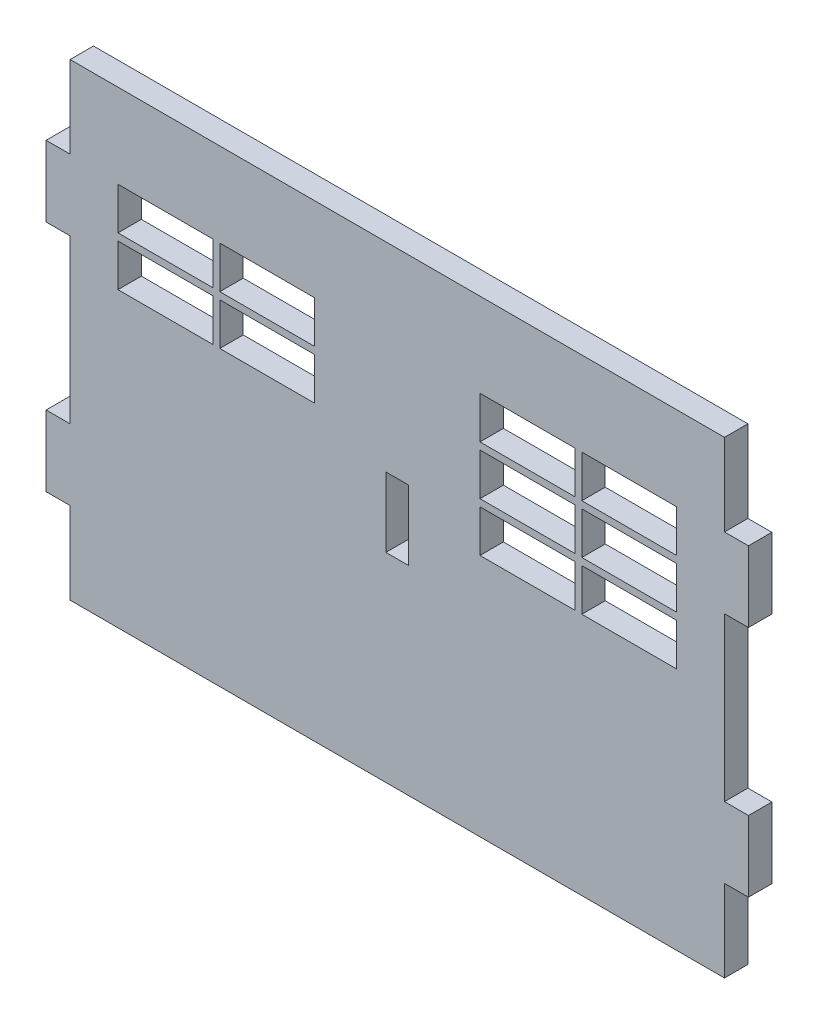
SolidWorks part; units mm, degrees
ref_plane "Front Plane" through (0, 0, 0) normal (0, 0, 1) x (1, 0, 0)
ref_plane "Top Plane" through (0, 0, 0) normal (0, 1, 0) x (1, 0, 0)
ref_plane "Right Plane" through (0, 0, 0) normal (1, 0, 0) x (0, 0, -1)
sketch "Laterale1" plane through (0, 0, 0) normal (0, 0, 1) x (1, 0, 0)
  line L0 (63.0435, 69.8758) -> (63.0435, -130.1242) construction
  line L1 (-76.7165, 69.8758) -> (202.8035, 69.8758)
  line L2 (-76.7165, 69.8758) -> (-76.7165, 34.8758)
  line L3 (-76.7165, -130.1242) -> (202.8035, -130.1242)
  line L4 (202.8035, 69.8758) -> (202.8035, 34.8758)
  line L5 (-14.2757, 33.9625) -> (-14.2757, -26.0375) construction
  line L6 (-56.2757, 33.9625) -> (-15.7757, 33.9625)
  line L7 (-56.2757, 33.9625) -> (-56.2757, 15.9625)
  line L8 (-56.2757, -26.0375) -> (-15.7757, -26.0375) construction
  line L9 (27.7243, 33.9625) -> (27.7243, 15.9625)
  line L10 (-15.7757, 33.9625) -> (-15.7757, 15.9625)
  line L11 (-56.2757, 15.9625) -> (-15.7757, 15.9625)
  line L12 (-56.2757, 12.9625) -> (-15.7757, 12.9625)
  line L13 (-56.2757, -5.0375) -> (-15.7757, -5.0375)
  line L14 (-56.2757, -8.0375) -> (-15.7757, -8.0375) construction
  line L15 (-56.2757, 12.9625) -> (-56.2757, -5.0375)
  line L16 (-56.2757, -8.0375) -> (-56.2757, -26.0375) construction
  line L17 (-15.7757, -8.0375) -> (-15.7757, -26.0375) construction
  line L18 (-15.7757, 12.9625) -> (-15.7757, -5.0375)
  line L19 (-12.7757, 33.9625) -> (27.7243, 33.9625)
  line L20 (-12.7757, -26.0375) -> (27.7243, -26.0375) construction
  line L21 (-12.7757, -8.0375) -> (-12.7757, -26.0375) construction
  line L22 (-12.7757, 12.9625) -> (-12.7757, -5.0375)
  line L23 (-12.7757, 33.9625) -> (-12.7757, 15.9625)
  line L24 (27.7243, -8.0375) -> (-12.7757, -8.0375) construction
  line L25 (27.7243, -5.0375) -> (-12.7757, -5.0375)
  line L26 (27.7243, 12.9625) -> (-12.7757, 12.9625)
  line L27 (27.7243, 15.9625) -> (-12.7757, 15.9625)
  line L28 (27.7243, -8.0375) -> (27.7243, -26.0375) construction
  line L29 (27.7243, 12.9625) -> (27.7243, -5.0375)
  line L30 (140.3626, 33.9625) -> (140.3626, -26.0375) construction
  line L31 (98.3626, 12.9625) -> (98.3626, -5.0375)
  line L32 (98.3626, -8.0375) -> (98.3626, -26.0375)
  line L33 (98.3626, 15.9625) -> (138.8626, 15.9625)
  line L34 (98.3626, 12.9625) -> (138.8626, 12.9625)
  line L35 (98.3626, -5.0375) -> (138.8626, -5.0375)
  line L36 (98.3626, -8.0375) -> (138.8626, -8.0375)
  line L37 (138.8626, 33.9625) -> (138.8626, 15.9625)
  line L38 (138.8626, 12.9625) -> (138.8626, -5.0375)
  line L39 (138.8626, -8.0375) -> (138.8626, -26.0375)
  line L40 (138.8626, -26.0375) -> (98.3626, -26.0375)
  line L41 (138.8626, 33.9625) -> (98.3626, 33.9625)
  line L42 (141.8626, 12.9625) -> (141.8626, -5.0375)
  line L43 (141.8626, -8.0375) -> (141.8626, -26.0375)
  line L44 (182.3626, -8.0375) -> (182.3626, -26.0375)
  line L45 (182.3626, 12.9625) -> (182.3626, -5.0375)
  line L46 (182.3626, -8.0375) -> (141.8626, -8.0375)
  line L47 (182.3626, -5.0375) -> (141.8626, -5.0375)
  line L48 (182.3626, 12.9625) -> (141.8626, 12.9625)
  line L49 (182.3626, 15.9625) -> (141.8626, 15.9625)
  line L50 (141.8626, 33.9625) -> (141.8626, 15.9625)
  line L51 (98.3626, 33.9625) -> (98.3626, 15.9625)
  line L52 (182.3626, -26.0375) -> (141.8626, -26.0375)
  line L53 (182.3626, 33.9625) -> (182.3626, 15.9625)
  line L54 (182.3626, 33.9625) -> (141.8626, 33.9625)
  line L55 (-76.7165, -30.1242) -> (223.2835, -30.1242) construction
  line L56 (-76.7165, 34.8758) -> (-86.9565, 34.8758)
  line L57 (-76.7165, -64.8842) -> (-86.9565, -64.8842)
  line L58 (-76.7165, 4.6358) -> (-86.9565, 4.6358)
  line L59 (-86.9565, 34.8758) -> (-86.9565, 4.6358)
  line L60 (-76.7165, 4.6358) -> (-76.7165, -64.8842)
  line L61 (-86.9565, -95.1242) -> (-86.9565, -64.8842)
  line L62 (-76.7165, -95.1242) -> (-86.9565, -95.1242)
  line L63 (-76.7165, -95.1242) -> (-76.7165, -130.1242)
  line L64 (202.8035, -95.1242) -> (213.0435, -95.1242)
  line L65 (213.0435, -95.1242) -> (213.0435, -64.8842)
  line L66 (202.8035, -64.8842) -> (213.0435, -64.8842)
  line L67 (202.8035, 4.6358) -> (213.0435, 4.6358)
  line L68 (213.0435, 34.8758) -> (213.0435, 4.6358)
  line L69 (202.8035, 34.8758) -> (213.0435, 34.8758)
  line L70 (202.8035, 4.6358) -> (202.8035, -64.8842)
  line L71 (202.8035, -95.1242) -> (202.8035, -130.1242)
  line L73 (58.1635, -45.0042) -> (67.9235, -45.0042)
  line L74 (58.1635, -45.0042) -> (58.1635, -15.2442)
  line L75 (58.1635, -15.2442) -> (67.9235, -15.2442)
  line L76 (67.9235, -45.0042) -> (67.9235, -15.2442)
  line L77 (58.1635, -45.0042) -> (67.9235, -15.2442) construction
  line L78 (58.1635, -15.2442) -> (67.9235, -45.0042) construction
  point P76 (63.0435, -30.1242)
extrude "Boss-Extrude1" add sketch "Laterale1" along normal blind 10
equation "\"HeightHouse\" = \"SCALE\"*200mm"
equation "\"LenghtHouse\"=\"SCALE\"* 300mm"
equation "\"WidthHouse\"= \"SCALE\"*230mm"
equation "\"ThicknessMaterial\"=10mm"
equation "\"Kerf\"= 0.12mm"
equation "\"WidthWindows\"=\"SCALE\"* 45mm"
equation "\"WidthDoor\"=\"SCALE\"* 60mm"
equation "\"HeightDoor\"=\"SCALE\"* 80mm"
equation "\"LenghtJoints\" =\"SCALE\"* 30mm"
equation "\"HeightWindows\"=\"SCALE\"* 60"
equation "\"Roof1\"=\"SCALE\"* 115mm"
equation "\"Roof2\"=\"SCALE\"* 140mm"
equation "\"WidthWindowFrame\"=\"SCALE\"* 3mm"
equation "\"D2@Laterale1\"=\"HeightHouse\""
equation "\"D3@Laterale1\"=\"WidthWindowFrame\""
equation "\"D4@Laterale1\"=\"WidthWindowFrame\""
equation "\"D5@Laterale1\"=\"WidthWindowFrame\"/2"
equation "\"D6@Laterale1\"=\"HeightWindows\""
equation "\"D7@Laterale1\"=84"
equation "\"D8@Laterale1\"=\"ThicknessMaterial\"+\"Kerf\"*2"
equation "\"D9@Laterale1\"=\"LenghtJoints\"+\"Kerf\"*2"
equation "\"D10@Laterale1\"=\"DistanceForJointsBody\""
equation "\"D1@Boss-Extrude1\"=\"ThicknessMaterial\""
equation "\"DistanceForJointsRoof\"=\"SCALE\"* 50mm"
equation "\"DistanceForJointsBody\"=\"SCALE\"* 35mm"
equation "\"CornerRoofBig\"=70deg"
equation "\"CornerRoofSmall\"= 60deg"
equation "\"D11@Laterale1\"=\"HeightHouse\"/2"
equation "\"D12@Laterale1\"=\"LenghtHouse\""
equation "\"D13@Laterale1\"=\"LenghtJoints\"-\"Kerf\"*2"
equation "\"D14@Laterale1\"=\"ThicknessMaterial\"-\"Kerf\"*2"
equation "\"LenghtRoof\"= \"LenghtHouse\"+(\"SCALE\"*40mm)"
equation "\"RoofSmall\"=\"SCALE\"* 120mm"
equation "\"RoofBig\"=\"SCALE\"* 170mm"
equation "\"TerraceLenght\"=\"SCALE\"* \"WidthWindows\"+35mm"
equation "\"TerraceHeight\"=\"SCALE\"* \"HeightWindows\"/2"
equation "\"LenghtJointTerrace\"=\"SCALE\"* 10mm"
equation "\"DistanceJointForChimney\"= \"SCALE\"* 10mm"
equation "\"HeightChimney\"= \"SCALE\"* 35mm"
equation "\"WidthChimney\"=\"SCALE\"* 20mm"
